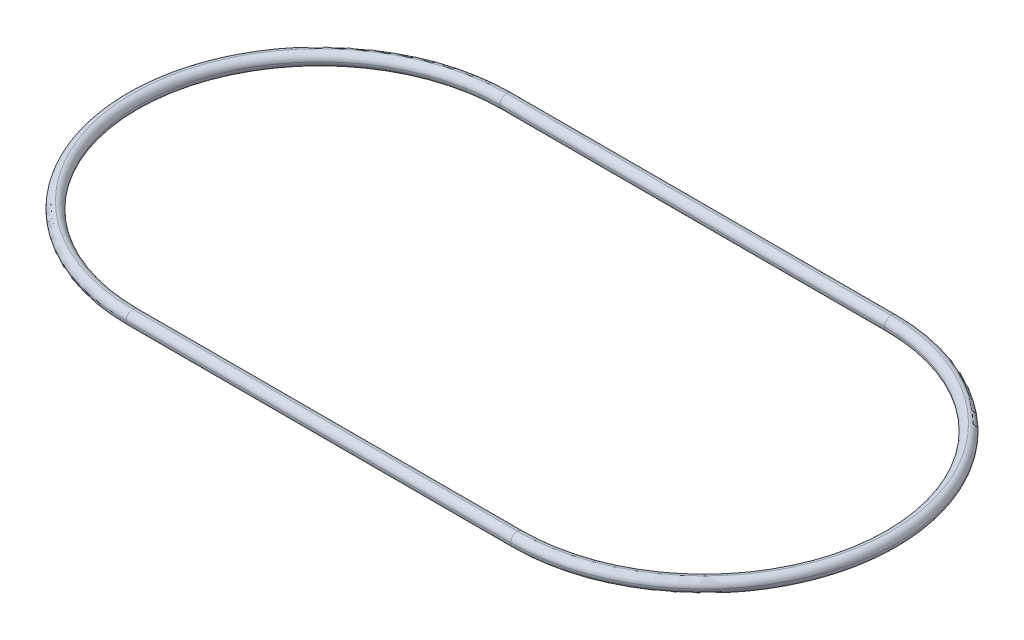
SolidWorks part; units mm, degrees
ref_plane "Plan de face" through (0, 0, 0) normal (0, 0, 1) x (1, 0, 0)
ref_plane "Plan de dessus" through (0, 0, 0) normal (0, 1, 0) x (1, 0, 0)
ref_plane "Plan de droite" through (0, 0, 0) normal (1, 0, 0) x (0, 0, -1)
sketch "Esquisse1" plane through (0, 0, 0) normal (0, 1, 0) x (1, 0, 0)
  line L0 (0, 72.5) -> (144, 72.5)
  line L2 (144, 67.5) -> (0, 67.5)
  line L4 (0, -67.5) -> (144, -67.5)
  line L6 (144, -72.5) -> (0, -72.5)
  arc A0 (0, 72.5) -> (0, -72.5) centre (0, 0) ccw
  arc A2 (0, 67.5) -> (0, -67.5) centre (0, 0) ccw
  arc A3 (144, -67.5) -> (144, 67.5) centre (144, 0) ccw
  arc A5 (144, -72.5) -> (144, 72.5) centre (144, 0) ccw
  dimension "D1" = 144
extrude "Extrusion1" add sketch "Esquisse1" along normal blind 5
fillet "Congé5" radius 2.5 24 edges at (216.5, 5, 0) (72, 5, -72.5) (211.5, 0, 0) (144, 2.5, 67.5) (72, 0, -67.5) (144, 2.5, -67.5) (-67.5, 0, 0) (0, 2.5, -67.5) (72, 0, 67.5) (0, 2.5, 67.5) (211.5, 5, 0) (72, 5, -67.5) (-67.5, 5, 0) (72, 5, 67.5) (-72.5, 5, 0) (72, 0, -72.5) (216.5, 0, 0) (72, 0, 72.5) (-72.5, 0, 0) (72, 5, 72.5) (0, 2.5, -72.5) (144, 2.5, -72.5) (144, 2.5, 72.5) (0, 2.5, 72.5)
